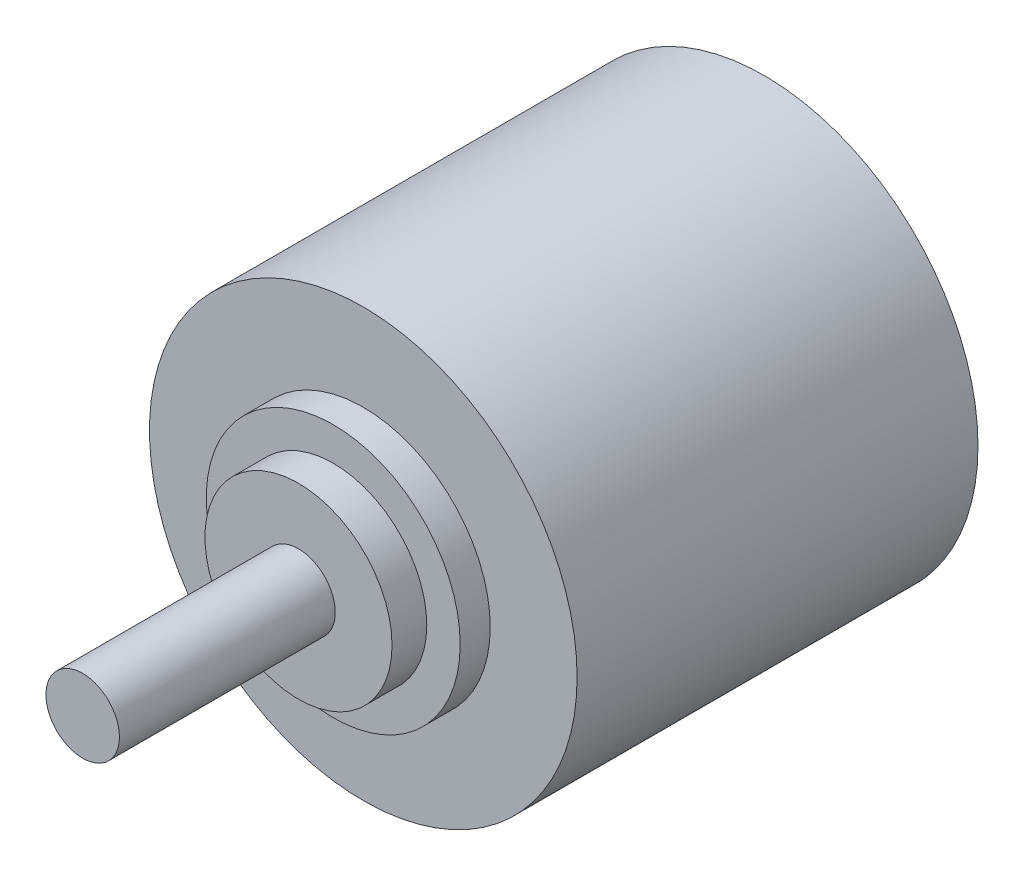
SolidWorks part; units mm, degrees
ref_plane "Front Plane" through (0, 0, 0) normal (0, 0, 1) x (1, 0, 0)
ref_plane "Top Plane" through (0, 0, 0) normal (0, 1, 0) x (1, 0, 0)
ref_plane "Right Plane" through (0, 0, 0) normal (1, 0, 0) x (0, 0, -1)
sketch "Sketch2" plane through (0, 0, 0) normal (0, 0, 1) x (1, 0, 0)
  circle A0 centre (-1.7906, 0) radius 16
  dimension "D1" = 32
extrude "Boss-Extrude1" add sketch "Sketch2" along normal blind 30
sketch "Sketch3" plane through (0, 0, 30) normal (0, 0, 1) x (1, 0, 0)
  circle A0 centre (-1.7906, 0) radius 9.5
  dimension "D1" = 19
extrude "Boss-Extrude2" add sketch "Sketch3" along normal blind 2.25
sketch "Sketch4" plane through (0, 0, 32.25) normal (0, 0, 1) x (1, 0, 0)
  circle A0 centre (-1.7906, 0) radius 7
  dimension "D1" = 14
extrude "Boss-Extrude3" add sketch "Sketch4" along normal blind 2.6
sketch "Sketch5" plane through (0, 0, 34.85) normal (0, 0, 1) x (1, 0, 0)
  circle A0 centre (-1.7906, 0) radius 2.75
  dimension "D1" = 5.5
extrude "Boss-Extrude4" add sketch "Sketch5" along normal blind 16.15
sketch "Sketch6" plane through (0, 0, 0) normal (0, 0, -1) x (-1, 0, 0)
  circle A0 centre (1.7906, 0) radius 5
  dimension "D1" = 10
extrude "Cut-Extrude1" cut sketch "Sketch6" against normal blind 2
sketch "Sketch7" plane through (0, 0, 2) normal (0, 0, -1) x (-1, 0, 0)
  circle A0 centre (1.7906, 0) radius 1.5
  dimension "D1" = 3
extrude "Cut-Extrude2" cut sketch "Sketch7" against normal blind 9
